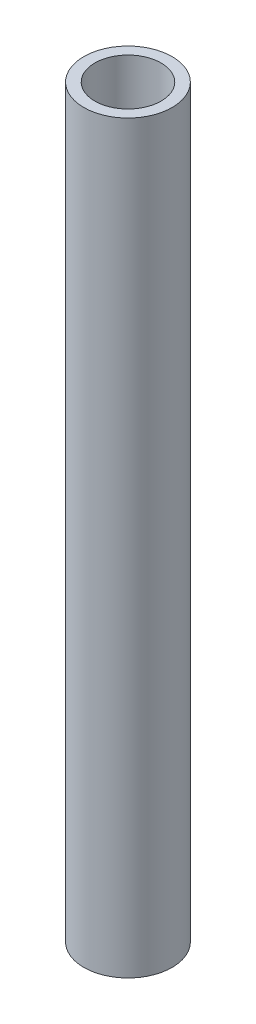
SolidWorks part; units mm, degrees
ref_plane "Front Plane" through (0, 0, 0) normal (0, 0, 1) x (1, 0, 0)
ref_plane "Top Plane" through (0, 0, 0) normal (0, 1, 0) x (1, 0, 0)
ref_plane "Right Plane" through (0, 0, 0) normal (1, 0, 0) x (0, 0, -1)
sketch "Sketch1" plane through (0, 0, 0) normal (0, 1, 0) x (1, 0, 0)
  circle A0 centre (0, 0) radius 6
  circle A1 centre (0, 0) radius 8
  dimension "D1" = 16
  dimension "D2" = 12
extrude "Boss-Extrude1" add sketch "Sketch1" along normal blind 135
